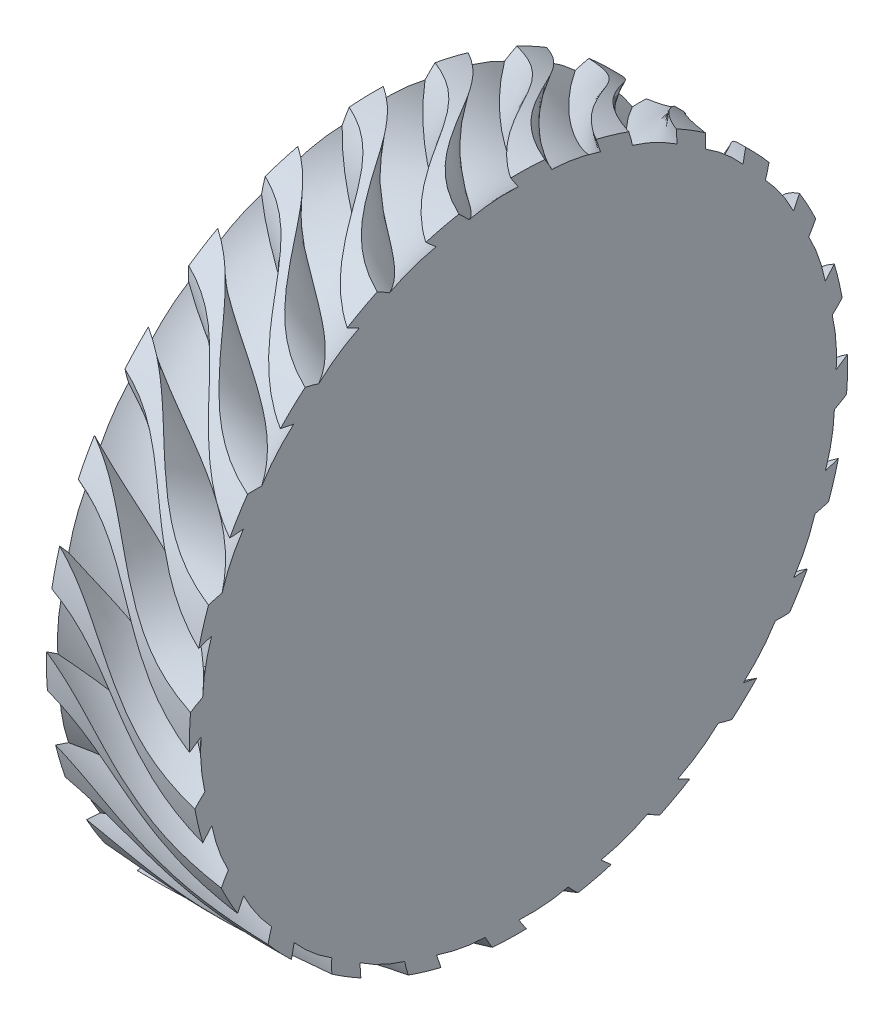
SolidWorks part; units mm, degrees
ref_plane "Front Plane" through (0, 0, 0) normal (0, 0, 1) x (1, 0, 0)
ref_plane "Top Plane" through (0, 0, 0) normal (0, 1, 0) x (1, 0, 0)
ref_plane "Right Plane" through (0, 0, 0) normal (1, 0, 0) x (0, 0, -1)
sketch "MainGeometry" plane through (0, 0, 0) normal (0, 0, 1) x (1, 0, 0)
  line L0 (-25.4251, 0) -> (32.6601, 0) construction
  line L1 (0, 0) -> (0, 80) construction
  line L2 (-15, 0) -> (15, 0)
  line L3 (-15, 0) -> (-15, 69)
  line L4 (-15, 69) -> (15, 69)
  line L5 (15, 0) -> (15, 69)
  line L6 (0, 80) -> (-20, 80) construction
  line L7 (-4, 70) -> (4, 70) construction
  line L8 (-4, 70) -> (-4, 62) construction
  line L9 (-4, 62) -> (4, 62) construction
  line L10 (4, 70) -> (4, 62) construction
  line L11 (50.3481, 57.4013) -> (56.3481, 57.4013) construction
  line L12 (49.5498, 46.5023) -> (73.5498, 46.5023) construction
  circle A0 centre (0, 80) radius 10 construction
  point P14 (0, 70)
  point P20 (56.3481, 57.4013)
  point P21 (53.5498, 46.5023)
revolve "Revolve1" add sketch "MainGeometry" angle 360 about L0
sketch "CamTurnPerFollower180" plane through (0, 0, 0) normal (1, 0, 0) x (0, 0, -1)
  line L0 (0, 80) -> (0, 0) construction
  line L1 (0, 0) -> (0, 80) construction
  line L2 (0, 0) -> (-56.5685, 56.5685) construction
  arc A0 (0, 80) -> (-56.5685, 56.5685) centre (0, 0) ccw
sketch "Sketch3" plane through (0, 0, 0) normal (0, 0, 1) x (1, 0, 0)
  line L0 (0, 80) -> (-20, 80) construction
  line L1 (0, 80) -> (-20, 80)
surface "Surface-Sweep1" parameters "D0"=180
thicken "Cut-Thicken1" surfaces to thicken 102 thickness 4 thickness side both sides parameters "D1"=4
pattern_circular "CirPattern2" count 24 over 360 about axis through (-25.4251, 0, 0) along (-1, 0, 0) of "Cut-Thicken1"
equation "\"D8@MainGeometry\" = \"D7@MainGeometry\" + 2"
equation "\"D1@Cut-Thicken1\"=\"D5@MainGeometry\""
equation "\"D1@CirPattern2\"=\"CamLobes@MainGeometry\""
equation "\"D1@CamTurnPerFollower180\"=pi*\"D2@CamTurnPerFollower180\"*(\"FollowerPins@MainGeometry\"/\"CamLobes@MainGeometry\")"
